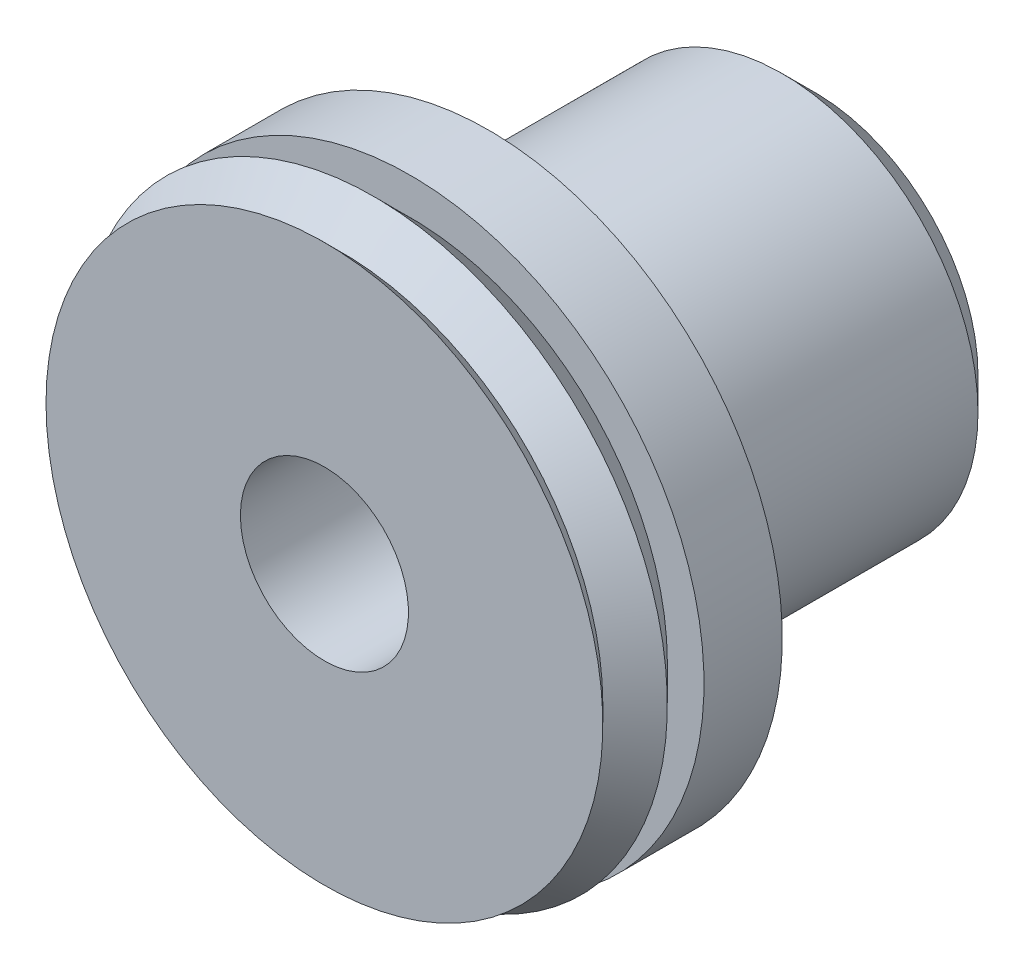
SolidWorks part; units mm, degrees
ref_plane "Front" through (0, 0, 0) normal (0, 0, 1) x (1, 0, 0)
ref_plane "Top" through (0, 0, 0) normal (0, 1, 0) x (1, 0, 0)
ref_plane "Right" through (0, 0, 0) normal (1, 0, 0) x (0, 0, -1)
ref_plane "Body Plane" through (0, 0, -3.9982) normal (0, 0, 1) x (1, 0, 0)
sketch "Sketch1" plane through (0, 0, 0) normal (1, 0, 0) x (0, 0, -1)
  line L0 (71.2941, 0) -> (-67.6458, 0) construction
  line L1 (0, 0) -> (0, 6.7754)
  line L2 (0, 6.7754) -> (0.4166, 6.3589)
  line L3 (0.4166, 6.3589) -> (1.2014, 7.1437)
  line L4 (1.2014, 7.1437) -> (2.0932, 6.252)
  line L5 (2.0932, 6.252) -> (2.0932, 7.1437)
  line L6 (2.0932, 7.1437) -> (3.9982, 7.1437)
  line L7 (3.9982, 7.1437) -> (3.9982, 0)
  line L8 (3.9982, 0) -> (0, 0)
  dimension "D1" = 45
  dimension "D2" = 7.1437
  dimension "D3" = 7.1437
  dimension "D4" = 0.8918
  dimension "D5" = 1.2014
  dimension "D6" = 6.7754
  dimension "Front Length" = 1.905
revolve "Base" add sketch "Sketch1" angle 360 about L0
sketch "Sketch15" plane through (0, 0, -3.9982) normal (0, 0, 1) x (1, 0, 0)
  circle A0 centre (0, 0) radius 4.7625
  dimension "D1" = 9.525
extrude "Single Acting Stud" add sketch "Sketch15" against normal blind 7.9375
chamfer "Single Acting Stud Chamfer" distance 0.7937 angle 45 1 edges at (4.7625, 0, -11.9357)
sketch "Sketch3" plane through (0, 0, 0) normal (0, 0, -1) x (-1, 0, 0)
  circle A0 centre (0, 0) radius 2.0447
  dimension "D1" = 4.0894
extrude "Hole Cut" cut sketch "Sketch3" along normal through all
